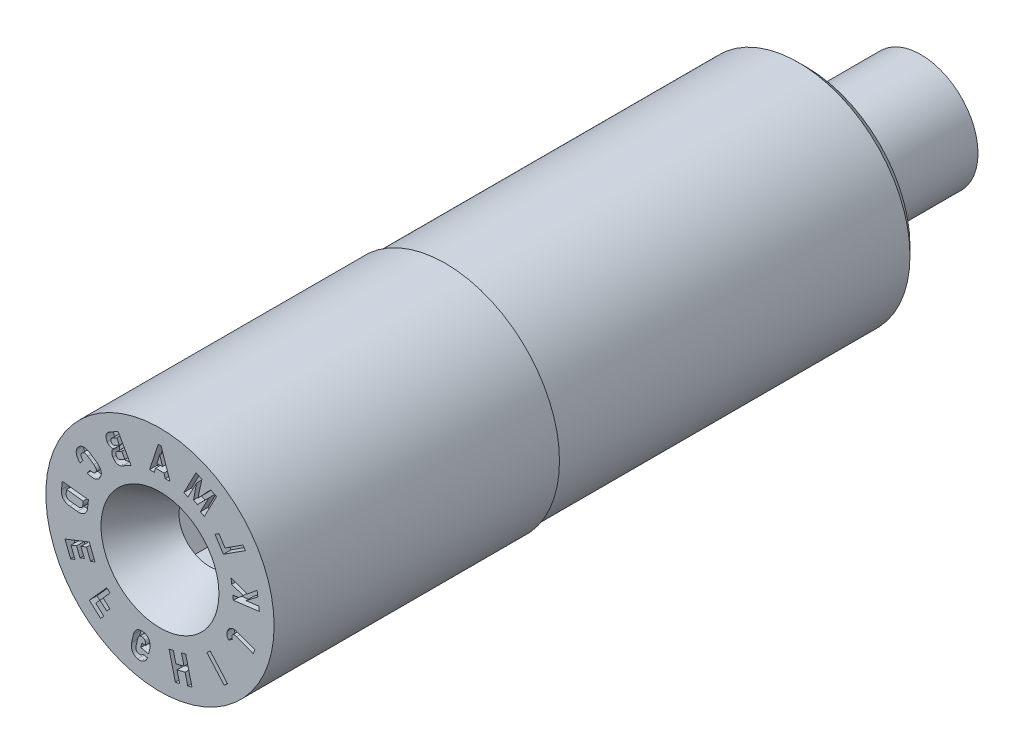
SolidWorks part; units mm, degrees
other "<M3L6-SetScrew>-<Chamfer1>"
ref_plane "Front Plane" through (0, 0, 0) normal (0, 0, 1) x (1, 0, 0)
ref_plane "Top Plane" through (0, 0, 0) normal (0, 1, 0) x (1, 0, 0)
ref_plane "Right Plane" through (0, 0, 0) normal (1, 0, 0) x (0, 0, -1)
sketch "Sketch1" plane through (0, 0, 0) normal (1, 0, 0) x (0, 0, -1)
  line L0 (0, 1.55) -> (1.299, 0.8)
  line L2 (0, 3) -> (0, 1.55)
  line L3 (16.7125, 3) -> (0, 3)
  line L4 (-3.7979, 0) -> (49996.2021, 0) construction
  line L8 (14, 0.8) -> (1.299, 0.8)
  line L12 (17, 1.5) -> (17, 2.7125)
  line L16 (17, 2.7125) -> (16.7125, 3)
  line L17 (17, 1.5) -> (14, 1.5)
  line L18 (14, 0.8) -> (14, 1.5)
  dimension "D1" = 17
  dimension "D2" = 45
  dimension "D3" = 0.2875
  dimension "D4" = 6
  dimension "D5" = 30
  dimension "D6" = 1.55
  dimension "D7" = 1.6
  dimension "D8" = 3
  dimension "D9" = 3
revolve "Revolve1" add sketch "Sketch1" angle 360 about L4
sketch "Sketch5" plane through (0, 0, 0) normal (1, 0, 0) x (0, 0, -1)
  line L0 (0, 0) -> (50000, 0) construction
  line L1 (0, 3) -> (0, -3) construction
  line L2 (7.5, 2.935) -> (17, 2.935)
  line L3 (7.5, 2.935) -> (7.5, 3.935)
  line L4 (7.5, 3.935) -> (17, 3.935)
  line L5 (17, 2.935) -> (17, 3.935)
  line L6 (17, -2.7125) -> (17, 2.7125) construction
  line L7 (16.7125, 3) -> (0, 3) construction
  dimension "D1" = 7.5
  dimension "D2" = 0.065
  dimension "D3" = 1
revolve "Cut-Revolve1" cut sketch "Sketch5" angle 360 about L0
sketch "Sketch2" plane through (0, 0, 0) normal (0, 0, 1) x (1, 0, 0)
  line L0 (0, 0) -> (0, 3) construction
  line L1 (0, 0) -> (1.3942, 2.6564) construction
  line L2 (0, 0) -> (2.469, 1.7042) construction
  line L3 (0, 0) -> (2.9781, 0.3616) construction
  line L4 (0, 0) -> (2.805, -1.0638) construction
  line L5 (0, 0) -> (1.9894, -2.2455) construction
  line L6 (0, 0) -> (0.7179, -2.9128) construction
  line L7 (0, 0) -> (-0.7179, -2.9128) construction
  line L8 (0, 0) -> (-1.9894, -2.2455) construction
  line L9 (0, 0) -> (-2.805, -1.0638) construction
  line L10 (0, 0) -> (-2.9781, 0.3616) construction
  line L11 (0, 0) -> (-2.469, 1.7042) construction
  line L12 (2.2591, 0.2002) -> (2.5723, 0.4407)
  line L13 (2.5723, 0.4407) -> (2.5537, 0.584)
  line L14 (2.5537, 0.584) -> (2.2946, 0.3683)
  line L15 (-1.0044, 1.9697) -> (-0.9226, 1.8252)
  line L16 (2.6124, 0.1302) -> (2.5976, 0.244)
  line L17 (2.5976, 0.244) -> (2.2591, 0.2002)
  line L18 (1.914, 0.1556) -> (1.9288, 0.0418)
  line L19 (1.9288, 0.0418) -> (2.6124, 0.1302)
  line L20 (2.1872, 0.2789) -> (2.0621, 0.1747)
  line L21 (2.2946, 0.3683) -> (1.8669, 0.5209)
  line L22 (1.8669, 0.5209) -> (1.8843, 0.3859)
  line L23 (1.8843, 0.3859) -> (2.1872, 0.2789)
  line L24 (2.2451, 1.3331) -> (2.183, 1.4295)
  line L25 (2.183, 1.4295) -> (1.7097, 1.1243)
  line L26 (0, 0) -> (-1.3942, 2.6564) construction
  line L27 (1.6668, 0.9602) -> (2.2451, 1.3331)
  line L28 (1.7101, 1.1237) -> (1.551, 1.3706)
  line L29 (1.551, 1.3706) -> (1.446, 1.3028)
  line L30 (1.446, 1.3028) -> (1.6668, 0.9602)
  line L31 (2.0621, 0.1747) -> (1.914, 0.1556)
  line L32 (0.0278, 2.6075) -> (-0.0449, 2.6072)
  line L33 (-0.0449, 2.6072) -> (-0.2741, 1.9163)
  line L34 (-0.2741, 1.9163) -> (-0.1509, 1.9168)
  line L35 (-0.1509, 1.9168) -> (-0.1173, 2.0274)
  line L36 (-0.0075, 2.3885) -> (0.066, 2.1534)
  line L37 (0.1396, 1.9179) -> (0.2628, 1.9184)
  line L38 (0.2628, 1.9184) -> (0.0278, 2.6075)
  line L39 (0.066, 2.1534) -> (-0.0792, 2.1528)
  line L40 (-0.0792, 2.1528) -> (-0.0075, 2.3885)
  line L41 (-0.1173, 2.0274) -> (0.1051, 2.0283)
  line L42 (0.1051, 2.0283) -> (0.1396, 1.9179)
  line L43 (-0.9226, 1.8252) -> (-1.0356, 1.7612)
  line L44 (-1.1479, 1.7919) -> (-1.1486, 1.7932)
  line L45 (-1.1175, 1.9057) -> (-1.0044, 1.9697)
  line L46 (-2.0757, -0.7319) -> (-1.932, -0.6756)
  line L47 (-1.0661, 2.0787) -> (-1.1791, 2.0147)
  line L48 (-1.252, 2.1436) -> (-1.139, 2.2076)
  line L49 (-1.4941, -1.6139) -> (-1.3114, -1.41)
  line L50 (-1.1008, 2.3731) -> (-1.317, 2.2507)
  line L51 (-1.2396, 1.7192) -> (-1.2389, 1.718)
  line L52 (-0.9833, 1.6468) -> (-0.7609, 1.7727)
  line L53 (0.6615, -2.228) -> (0.7298, -2.5057)
  line L54 (0.4184, -2.1583) -> (0.3515, -1.8861)
  line L55 (-1.139, 2.2076) -> (-1.0661, 2.0787)
  line L56 (1.1002, 2.382) -> (0.9482, 2.4613)
  line L57 (-0.7609, 1.7727) -> (-1.1008, 2.3731)
  line L58 (-1.6724, 1.3979) -> (-1.8288, 1.5049)
  line L59 (-2.0935, 1.1528) -> (-2.0261, 1.2512)
  line L60 (-1.8962, 1.4063) -> (-1.7399, 1.2993)
  line L61 (-1.838, 1.1225) -> (-1.9054, 1.0241)
  line L62 (-2.0183, 0.3268) -> (-2.028, 0.2384)
  line L63 (-2.1586, 0.1339) -> (-2.3606, 0.1563)
  line L64 (-2.4649, 0.2869) -> (-2.4552, 0.3753)
  line L65 (0.9482, 2.4613) -> (0.6291, 1.8494)
  line L66 (-2.5671, 0.5028) -> (-2.5893, 0.3031)
  line L67 (-2.3699, 0.0381) -> (-2.1754, 0.0165)
  line L68 (-1.9032, 0.2275) -> (-1.881, 0.4267)
  line L69 (0.6291, 1.8494) -> (0.734, 1.7948)
  line L70 (0.734, 1.7948) -> (0.9604, 2.2291)
  line L71 (-2.4552, 0.3753) -> (-2.0183, 0.3268)
  line L72 (0.9604, 2.2291) -> (0.8823, 1.8042)
  line L73 (-1.881, 0.4267) -> (-2.5671, 0.5028)
  line L74 (0.8823, 1.8042) -> (0.9842, 1.7511)
  line L75 (-2.3401, -0.8355) -> (-2.192, -0.7775)
  line L76 (0.9842, 1.7511) -> (1.2838, 2.0506)
  line L77 (-1.8574, -0.5236) -> (-2.4982, -0.7747)
  line L78 (-1.932, -0.6756) -> (-1.8254, -0.9477)
  line L79 (-1.8254, -0.9477) -> (-1.7092, -0.9021)
  line L80 (-1.7092, -0.9021) -> (-1.8574, -0.5236)
  line L81 (1.2838, 2.0506) -> (1.0614, 1.6241)
  line L82 (-2.192, -0.7775) -> (-2.1022, -1.0068)
  line L83 (-2.1022, -1.0068) -> (-1.9859, -0.9612)
  line L84 (-1.9859, -0.9612) -> (-2.0757, -0.7319)
  line L85 (1.0614, 1.6241) -> (1.1662, 1.5695)
  line L86 (-2.4982, -0.7747) -> (-2.3499, -1.1533)
  line L87 (-2.3499, -1.1533) -> (-2.2335, -1.1076)
  line L88 (-2.2335, -1.1076) -> (-2.3401, -0.8355)
  line L89 (1.1662, 1.5695) -> (1.4853, 2.1813)
  line L90 (1.4853, 2.1813) -> (1.3333, 2.2604)
  line L91 (-1.6883, -1.8306) -> (-1.5778, -1.7073)
  line L92 (-1.3114, -1.41) -> (-1.3968, -1.3335)
  line L93 (-1.3968, -1.3335) -> (-1.8572, -1.8475)
  line L94 (-1.5778, -1.7073) -> (-1.4001, -1.8664)
  line L95 (-1.4001, -1.8664) -> (-1.3165, -1.7731)
  line L96 (-1.3165, -1.7731) -> (-1.4941, -1.6139)
  line L97 (1.3333, 2.2604) -> (1.0017, 1.9089)
  line L98 (-1.8572, -1.8475) -> (-1.56, -2.1137)
  line L99 (-1.56, -2.1137) -> (-1.4764, -2.0204)
  line L100 (-1.4764, -2.0204) -> (-1.6883, -1.8306)
  line L101 (1.0017, 1.9089) -> (1.1002, 2.382)
  line L102 (-0.2986, -2.2942) -> (-0.2686, -2.1627)
  line L103 (-0.6983, -2.0491) -> (-0.7436, -2.2477)
  line L104 (-0.3272, -2.3967) -> (-0.4477, -2.3692)
  line L105 (-0.628, -2.274) -> (-0.5827, -2.0755)
  line L106 (-0.3837, -2.1345) -> (-0.3863, -2.1456)
  line L107 (-0.3863, -2.1456) -> (-0.4759, -2.1252)
  line L108 (-0.4759, -2.1252) -> (-0.5039, -2.2473)
  line L109 (-0.5039, -2.2473) -> (-0.2986, -2.2942)
  line L110 (0.7298, -2.5057) -> (0.8415, -2.4783)
  line L111 (0.8415, -2.4783) -> (0.6763, -1.8062)
  line L112 (0.6763, -1.8062) -> (0.5645, -1.8337)
  line L113 (0.5645, -1.8337) -> (0.6315, -2.1059)
  line L114 (0.4049, -2.5857) -> (0.5167, -2.5582)
  line L115 (0.5167, -2.5582) -> (0.4484, -2.2804)
  line L116 (0.3515, -1.8861) -> (0.2396, -1.9136)
  line L117 (0.2396, -1.9136) -> (0.4049, -2.5857)
  line L118 (0.4484, -2.2804) -> (0.6615, -2.228)
  line L120 (0.6315, -2.1059) -> (0.4184, -2.1583)
  line L122 (1.8012, -0.9222) -> (1.9069, -0.8626)
  line L123 (2.012, -0.7432) -> (2.4495, -0.9121)
  line L124 (2.4495, -0.9121) -> (2.4924, -0.8012)
  line L125 (2.4924, -0.8012) -> (2.0545, -0.632)
  line L126 (1.3203, -1.4144) -> (1.2312, -1.4926)
  line L127 (1.2312, -1.4926) -> (1.6866, -2.0112)
  line L128 (1.6866, -2.0112) -> (1.7757, -1.933)
  line L129 (1.7757, -1.933) -> (1.3203, -1.4144)
  circle A0 centre (0, 0) radius 3 construction
  circle A1 centre (0, 0) radius 1.9375 construction
  spline S0 degree 3 poles (-1.0356, 1.7612) (-1.0459, 1.7554) (-1.0619, 1.7485) (-1.0842, 1.7471) (-1.0995, 1.7493) (-1.1138, 1.7552) (-1.132, 1.7678) (-1.1421, 1.7818) (-1.1479, 1.7919) knots 0 0 0 0 0.26905 0.386758 0.5017 0.616922 0.734143 1 1 1 1
  spline S1 degree 3 poles (-1.1486, 1.7932) (-1.1523, 1.8003) (-1.1578, 1.8109) (-1.1611, 1.8259) (-1.1623, 1.8365) (-1.1618, 1.8468) (-1.1601, 1.8568) (-1.1564, 1.8663) (-1.1515, 1.8754) (-1.1452, 1.884) (-1.1342, 1.8948) (-1.1245, 1.9017) (-1.1175, 1.9057) knots 0 0 0 0 0.182941 0.266967 0.346528 0.423909 0.49977 0.575297 0.652801 0.732708 0.816841 1 1 1 1
  spline S2 degree 3 poles (-1.1791, 2.0147) (-1.1883, 2.0093) (-1.2029, 2.0037) (-1.2231, 2.0022) (-1.2371, 2.0048) (-1.2503, 2.0106) (-1.2671, 2.0229) (-1.2768, 2.0361) (-1.2821, 2.0458) knots 0 0 0 0 0.261977 0.377727 0.49196 0.607887 0.727892 1 1 1 1
  spline S3 degree 3 poles (-1.2821, 2.0458) (-1.2871, 2.0544) (-1.2927, 2.0682) (-1.2937, 2.0873) (-1.2911, 2.1006) (-1.2857, 2.1132) (-1.2738, 2.1292) (-1.2612, 2.1384) (-1.252, 2.1436) knots 0 0 0 0 0.258446 0.374554 0.489401 0.605415 0.725691 1 1 1 1
  spline S4 degree 3 poles (-1.317, 2.2507) (-1.333, 2.2416) (-1.3552, 2.2264) (-1.3798, 2.2017) (-1.3943, 2.1823) (-1.4055, 2.1618) (-1.4134, 2.1403) (-1.4176, 2.1177) (-1.4184, 2.0943) (-1.4157, 2.0703) (-1.4073, 2.0365) (-1.3961, 2.0121) (-1.387, 1.9962) knots 0 0 0 0 0.184023 0.26743 0.347474 0.424849 0.500285 0.576178 0.653357 0.733286 0.817102 1 1 1 1
  spline S5 degree 3 poles (-1.387, 1.9962) (-1.381, 1.9849) (-1.3701, 1.9696) (-1.3534, 1.9517) (-1.34, 1.9408) (-1.3259, 1.9315) (-1.311, 1.9244) (-1.2954, 1.9193) (-1.2791, 1.9163) (-1.2623, 1.9153) (-1.2387, 1.9167) (-1.2211, 1.9209) (-1.2094, 1.9248) knots 0 0 0 0 0.182465 0.267267 0.349177 0.428902 0.506921 0.58456 0.663164 0.743124 0.825026 1 1 1 1
  spline S6 degree 3 poles (-1.2094, 1.9248) (-1.2197, 1.9169) (-1.2334, 1.9035) (-1.2478, 1.883) (-1.2562, 1.867) (-1.2621, 1.8501) (-1.266, 1.8327) (-1.2675, 1.8146) (-1.2664, 1.7961) (-1.2634, 1.7771) (-1.2555, 1.7508) (-1.2469, 1.7316) (-1.2396, 1.7192) knots 0 0 0 0 0.169562 0.248935 0.327655 0.405299 0.482357 0.56114 0.641663 0.725284 0.812159 1 1 1 1
  spline S7 degree 3 poles (-1.2389, 1.718) (-1.2298, 1.7019) (-1.2146, 1.6794) (-1.1896, 1.6548) (-1.1702, 1.6401) (-1.1496, 1.6286) (-1.1279, 1.6208) (-1.1053, 1.6163) (-1.0818, 1.6155) (-1.0577, 1.618) (-1.0238, 1.6266) (-0.9992, 1.6375) (-0.9833, 1.6468) knots 0 0 0 0 0.18374 0.267641 0.347802 0.425241 0.500762 0.57656 0.653764 0.733671 0.817074 1 1 1 1
  spline S8 degree 3 poles (-1.5851, 1.0701) (-1.5789, 1.0794) (-1.5701, 1.0935) (-1.5606, 1.1131) (-1.5545, 1.1275) (-1.55, 1.1421) (-1.5461, 1.1565) (-1.5438, 1.1711) (-1.5422, 1.1856) (-1.5422, 1.2001) (-1.5429, 1.2145) (-1.545, 1.2287) (-1.5483, 1.2427) (-1.5524, 1.2567) (-1.5578, 1.2707) (-1.5645, 1.2844) (-1.5721, 1.298) (-1.581, 1.3113) (-1.5907, 1.3245) (-1.6017, 1.3374) (-1.6138, 1.35) (-1.6269, 1.3624) (-1.646, 1.379) (-1.6616, 1.3905) (-1.6724, 1.3979) knots 0 0 0 0 0.087233 0.129069 0.169541 0.209036 0.247781 0.286035 0.323896 0.361474 0.39854 0.435835 0.472937 0.510947 0.549563 0.589025 0.629545 0.67095 0.713741 0.757409 0.802834 0.849349 0.89775 1 1 1 1
  spline S9 degree 3 poles (-1.8288, 1.5049) (-1.8396, 1.5124) (-1.8561, 1.5225) (-1.8783, 1.5347) (-1.8948, 1.5422) (-1.9108, 1.5491) (-1.9269, 1.5544) (-1.9427, 1.5589) (-1.9584, 1.5623) (-1.9738, 1.5645) (-1.989, 1.5657) (-2.0039, 1.5656) (-2.0185, 1.5647) (-2.0328, 1.5624) (-2.0468, 1.5591) (-2.0606, 1.555) (-2.074, 1.5495) (-2.087, 1.5429) (-2.0998, 1.5355) (-2.112, 1.5268) (-2.1239, 1.5172) (-2.1352, 1.5064) (-2.1499, 1.4904) (-2.1602, 1.4774) (-2.1665, 1.468) knots 0 0 0 0 0.102142 0.150603 0.197513 0.242633 0.28651 0.329076 0.370739 0.411156 0.45052 0.489036 0.527074 0.564224 0.601656 0.638856 0.676278 0.714231 0.752196 0.791151 0.8305 0.870939 0.912582 1 1 1 1
  spline S10 degree 3 poles (-2.1665, 1.468) (-2.1768, 1.4529) (-2.1895, 1.4285) (-2.1991, 1.3937) (-2.2021, 1.3672) (-2.2017, 1.3403) (-2.1971, 1.3132) (-2.1889, 1.2859) (-2.177, 1.2586) (-2.1615, 1.2314) (-2.135, 1.1946) (-2.1111, 1.169) (-2.0935, 1.1528) knots 0 0 0 0 0.154567 0.229209 0.303547 0.378669 0.45516 0.534686 0.617985 0.705746 0.798149 1 1 1 1
  spline S11 degree 3 poles (-2.0261, 1.2512) (-2.0339, 1.2589) (-2.0442, 1.2712) (-2.0558, 1.2884) (-2.0626, 1.301) (-2.0678, 1.3136) (-2.0715, 1.326) (-2.0736, 1.3383) (-2.074, 1.3503) (-2.073, 1.3621) (-2.0691, 1.3773) (-2.0636, 1.388) (-2.0592, 1.3945) knots 0 0 0 0 0.204978 0.299357 0.388937 0.473703 0.553626 0.630555 0.705965 0.778794 0.851518 1 1 1 1
  spline S12 degree 3 poles (-2.0592, 1.3945) (-2.0535, 1.4028) (-2.0438, 1.4143) (-2.028, 1.4256) (-2.0157, 1.432) (-2.0027, 1.436) (-1.989, 1.4381) (-1.9746, 1.4378) (-1.9596, 1.4358) (-1.9442, 1.4313) (-1.9223, 1.4228) (-1.9066, 1.4132) (-1.8962, 1.4063) knots 0 0 0 0 0.163821 0.239689 0.313407 0.386873 0.460423 0.537618 0.61862 0.705136 0.796781 1 1 1 1
  spline S13 degree 3 poles (-1.7399, 1.2993) (-1.7297, 1.2921) (-1.7152, 1.281) (-1.6993, 1.2638) (-1.6898, 1.251) (-1.6823, 1.2379) (-1.6772, 1.2245) (-1.674, 1.2111) (-1.6733, 1.1974) (-1.6744, 1.1837) (-1.6799, 1.1651) (-1.6864, 1.1517) (-1.6924, 1.1436) knots 0 0 0 0 0.203418 0.294737 0.380965 0.461768 0.538625 0.612958 0.685938 0.760134 0.83614 1 1 1 1
  spline S14 degree 3 poles (-1.6924, 1.1436) (-1.6971, 1.137) (-1.7049, 1.1277) (-1.7178, 1.1184) (-1.7283, 1.1129) (-1.7396, 1.109) (-1.7518, 1.1063) (-1.7647, 1.1054) (-1.7783, 1.1058) (-1.7925, 1.1077) (-1.8129, 1.1122) (-1.8278, 1.1182) (-1.838, 1.1225) knots 0 0 0 0 0.150261 0.223488 0.296087 0.370429 0.446836 0.527115 0.610974 0.700548 0.794181 1 1 1 1
  spline S15 degree 3 poles (-1.9054, 1.0241) (-1.8837, 1.014) (-1.8513, 1.0004) (-1.8072, 0.9896) (-1.7763, 0.9848) (-1.7466, 0.9837) (-1.7182, 0.9857) (-1.6914, 0.9915) (-1.666, 1.0005) (-1.6426, 1.0131) (-1.6134, 1.0341) (-1.5956, 1.055) (-1.5851, 1.0701) knots 0 0 0 0 0.202203 0.294606 0.382493 0.465999 0.545154 0.621761 0.69694 0.771301 0.845139 1 1 1 1
  spline S16 degree 3 poles (-2.028, 0.2384) (-2.029, 0.2295) (-2.0312, 0.2166) (-2.0365, 0.2005) (-2.0409, 0.1895) (-2.0467, 0.1796) (-2.0529, 0.1703) (-2.0603, 0.1622) (-2.0684, 0.1549) (-2.0772, 0.1486) (-2.0868, 0.1433) (-2.0971, 0.139) (-2.1081, 0.1359) (-2.1198, 0.1337) (-2.1367, 0.1325) (-2.1497, 0.1329) (-2.1586, 0.1339) knots 0 0 0 0 0.140586 0.205164 0.267373 0.327599 0.385572 0.443109 0.50013 0.557324 0.614345 0.672558 0.732716 0.794789 0.859227 1 1 1 1
  spline S17 degree 3 poles (-2.3606, 0.1563) (-2.3695, 0.1572) (-2.3823, 0.1597) (-2.3986, 0.1645) (-2.4095, 0.1693) (-2.4196, 0.1748) (-2.4288, 0.1811) (-2.4369, 0.1884) (-2.4442, 0.1966) (-2.4506, 0.2054) (-2.4557, 0.2151) (-2.46, 0.2254) (-2.4632, 0.2364) (-2.4651, 0.2481) (-2.4667, 0.265) (-2.4657, 0.278) (-2.4649, 0.2869) knots 0 0 0 0 0.140512 0.205608 0.268014 0.327901 0.385841 0.443345 0.500333 0.557494 0.614693 0.672873 0.732996 0.794844 0.859368 1 1 1 1
  spline S18 degree 3 poles (-2.5893, 0.3031) (-2.5906, 0.291) (-2.5916, 0.273) (-2.5915, 0.2494) (-2.5899, 0.2325) (-2.5879, 0.2162) (-2.5844, 0.2006) (-2.5802, 0.1856) (-2.5751, 0.1711) (-2.5689, 0.1573) (-2.5617, 0.1443) (-2.5537, 0.1319) (-2.5448, 0.1201) (-2.535, 0.1091) (-2.5242, 0.0989) (-2.5125, 0.0893) (-2.5, 0.0804) (-2.4865, 0.0725) (-2.4723, 0.065) (-2.4571, 0.0586) (-2.4412, 0.0529) (-2.4245, 0.048) (-2.4008, 0.0424) (-2.3824, 0.0395) (-2.3699, 0.0381) knots 0 0 0 0 0.093432 0.137818 0.181158 0.222724 0.263627 0.30352 0.342577 0.38116 0.419013 0.456656 0.494298 0.531898 0.569704 0.608161 0.647276 0.687272 0.728161 0.770184 0.813308 0.857685 0.90345 1 1 1 1
  spline S19 degree 3 poles (-2.1754, 0.0165) (-2.1635, 0.015) (-2.1457, 0.0141) (-2.1223, 0.0141) (-2.1055, 0.0153) (-2.0892, 0.0174) (-2.0734, 0.0203) (-2.0581, 0.0241) (-2.0433, 0.0288) (-2.0291, 0.0344) (-2.0155, 0.0409) (-2.0027, 0.0485) (-1.9903, 0.0567) (-1.9788, 0.0661) (-1.968, 0.0765) (-1.9578, 0.0876) (-1.9483, 0.0997) (-1.9396, 0.1127) (-1.9317, 0.1265) (-1.9247, 0.1412) (-1.9185, 0.1568) (-1.9135, 0.1733) (-1.9074, 0.1967) (-1.9046, 0.215) (-1.9032, 0.2275) knots 0 0 0 0 0.092119 0.136531 0.179458 0.221355 0.26236 0.30262 0.342291 0.381213 0.419577 0.45779 0.495646 0.533544 0.571504 0.610206 0.649406 0.689332 0.730199 0.771744 0.814183 0.858418 0.904002 1 1 1 1
  spline S20 degree 3 poles (-0.2686, -2.1627) (-0.2659, -2.1506) (-0.2625, -2.1325) (-0.26, -2.1084) (-0.259, -2.0909) (-0.2591, -2.0738) (-0.26, -2.0571) (-0.2621, -2.0407) (-0.265, -2.0247) (-0.2687, -2.0092) (-0.2736, -1.9944) (-0.2791, -1.9801) (-0.2856, -1.9665) (-0.2931, -1.9536) (-0.3012, -1.9413) (-0.3105, -1.9298) (-0.3204, -1.9188) (-0.3311, -1.9086) (-0.3428, -1.8994) (-0.3549, -1.8908) (-0.3678, -1.8833) (-0.3815, -1.8766) (-0.4009, -1.8687) (-0.4161, -1.8642) (-0.4265, -1.8618) knots 0 0 0 0 0.097617 0.144298 0.190203 0.234736 0.278397 0.321803 0.364168 0.406122 0.446692 0.48669 0.526219 0.564751 0.603265 0.64199 0.680567 0.719496 0.757996 0.796937 0.835914 0.875622 0.916265 1 1 1 1
  spline S21 degree 3 poles (-0.4265, -1.8618) (-0.437, -1.8593) (-0.4527, -1.8569) (-0.4737, -1.8551) (-0.489, -1.8552) (-0.504, -1.8561) (-0.5188, -1.8578) (-0.5332, -1.861) (-0.5474, -1.865) (-0.5612, -1.8699) (-0.5745, -1.876) (-0.5872, -1.8828) (-0.5995, -1.8905) (-0.6112, -1.8992) (-0.6224, -1.9089) (-0.6329, -1.9195) (-0.6431, -1.9309) (-0.6524, -1.9432) (-0.6614, -1.956) (-0.6693, -1.9698) (-0.6766, -1.9843) (-0.6832, -1.9994) (-0.6909, -2.021) (-0.6959, -2.0376) (-0.6983, -2.0491) knots 0 0 0 0 0.086815 0.128493 0.169609 0.210194 0.250046 0.289654 0.329266 0.368727 0.407618 0.446765 0.485286 0.524719 0.564216 0.604518 0.64549 0.687131 0.729071 0.771906 0.815214 0.85988 0.905255 1 1 1 1
  spline S22 degree 3 poles (-0.7436, -2.2477) (-0.7463, -2.2598) (-0.7496, -2.2779) (-0.7522, -2.3021) (-0.7531, -2.3195) (-0.753, -2.3366) (-0.7521, -2.3533) (-0.75, -2.3696) (-0.7472, -2.3855) (-0.7433, -2.4009) (-0.7386, -2.4157) (-0.733, -2.4299) (-0.7265, -2.4434) (-0.7192, -2.4563) (-0.711, -2.4686) (-0.7017, -2.4801) (-0.6918, -2.4911) (-0.6809, -2.5011) (-0.6696, -2.5106) (-0.6574, -2.519) (-0.6445, -2.5265) (-0.6308, -2.5332) (-0.6114, -2.5411) (-0.5962, -2.5455) (-0.5858, -2.5479) knots 0 0 0 0 0.097786 0.144914 0.190535 0.235145 0.278881 0.322016 0.364454 0.406151 0.446791 0.486554 0.525633 0.564503 0.603084 0.641875 0.680519 0.719328 0.758058 0.796586 0.835631 0.875408 0.916121 1 1 1 1
  spline S23 degree 3 poles (-0.5858, -2.5479) (-0.5687, -2.5518) (-0.5424, -2.5548) (-0.5076, -2.5518) (-0.4823, -2.546) (-0.4576, -2.5374) (-0.4342, -2.5253) (-0.4119, -2.5106) (-0.3912, -2.4927) (-0.372, -2.4723) (-0.3487, -2.4412) (-0.335, -2.415) (-0.3272, -2.3967) knots 0 0 0 0 0.161055 0.240119 0.319613 0.39948 0.479531 0.560487 0.644137 0.729965 0.817215 1 1 1 1
  spline S24 degree 3 poles (-0.4477, -2.3692) (-0.4512, -2.3756) (-0.4575, -2.3845) (-0.4676, -2.3949) (-0.476, -2.4015) (-0.4851, -2.4071) (-0.4945, -2.4116) (-0.5043, -2.4152) (-0.5246, -2.42) (-0.5423, -2.4194) (-0.5557, -2.4165) knots 0 0 0 0 0.17307 0.257817 0.342272 0.426288 0.508487 0.590416 0.673346 1 1 1 1
  spline S25 degree 3 poles (-0.5557, -2.4165) (-0.5651, -2.4143) (-0.5787, -2.4096) (-0.5945, -2.3992) (-0.6049, -2.3901) (-0.6138, -2.3794) (-0.6208, -2.3673) (-0.6265, -2.354) (-0.6304, -2.3396) (-0.6325, -2.3242) (-0.633, -2.3021) (-0.6306, -2.2852) (-0.628, -2.274) knots 0 0 0 0 0.160706 0.237501 0.314236 0.391285 0.468827 0.547922 0.631285 0.717518 0.80715 1 1 1 1
  spline S26 degree 3 poles (-0.5827, -2.0755) (-0.5804, -2.0656) (-0.5758, -2.0512) (-0.5662, -2.034) (-0.5577, -2.0228) (-0.5482, -2.013) (-0.5376, -2.0047) (-0.5258, -1.9984) (-0.5131, -1.9937) (-0.4997, -1.9909) (-0.4807, -1.9891) (-0.4662, -1.9913) (-0.4566, -1.9933) knots 0 0 0 0 0.180297 0.26421 0.346936 0.427679 0.505999 0.584125 0.663209 0.743675 0.825457 1 1 1 1
  spline S27 degree 3 poles (-0.4566, -1.9933) (-0.4471, -1.9956) (-0.4333, -2.0002) (-0.4173, -2.0104) (-0.4068, -2.0192) (-0.3979, -2.0296) (-0.3907, -2.0413) (-0.3851, -2.0543) (-0.3813, -2.0685) (-0.3791, -2.0838) (-0.3786, -2.1061) (-0.3813, -2.123) (-0.3837, -2.1345) knots 0 0 0 0 0.163193 0.240603 0.316743 0.391895 0.467889 0.546499 0.628266 0.713929 0.80373 1 1 1 1
  spline S28 degree 3 poles (1.7738, -0.7318) (1.7674, -0.7484) (1.7604, -0.7739) (1.7584, -0.8086) (1.7602, -0.8336) (1.7654, -0.8578) (1.7768, -0.8888) (1.7906, -0.9096) (1.8012, -0.9222) knots 0 0 0 0 0.264095 0.388879 0.512536 0.634397 0.755301 1 1 1 1
  spline S29 degree 3 poles (1.9069, -0.8626) (1.9021, -0.8557) (1.8962, -0.8445) (1.891, -0.8287) (1.8884, -0.8169) (1.8875, -0.805) (1.888, -0.7896) (1.8908, -0.7784) (1.8935, -0.7713) knots 0 0 0 0 0.265014 0.391861 0.519139 0.642856 0.763156 1 1 1 1
  spline S30 degree 3 poles (1.8935, -0.7713) (1.8971, -0.7619) (1.9053, -0.7488) (1.9221, -0.7375) (1.9368, -0.7324) (1.9534, -0.7306) (1.9792, -0.7321) (1.9988, -0.7382) (2.012, -0.7432) knots 0 0 0 0 0.220694 0.325991 0.436994 0.556707 0.688683 1 1 1 1
  spline S31 degree 3 poles (2.0545, -0.632) (2.0337, -0.6243) (2.0028, -0.6144) (1.9613, -0.6092) (1.9328, -0.6086) (1.9058, -0.6119) (1.8806, -0.6186) (1.8573, -0.629) (1.8359, -0.6429) (1.8167, -0.6603) (1.7935, -0.6887) (1.7806, -0.7138) (1.7738, -0.7318) knots 0 0 0 0 0.197119 0.286068 0.37004 0.450102 0.526194 0.600935 0.675643 0.75178 0.829873 1 1 1 1
  point P17 (0, 0)
  dimension "D1" = 13
  dimension "D2" = 3.875
extrude "Cut-Extrude1" cut sketch "Sketch2" against normal blind 0.2
ref_plane "Plane1" through (0, 0, -1.299) normal (0, 0, 1) x (1, 0, 0)
sketch "Sketch7" plane through (0, 0, -1.299) normal (0, 0, 1) x (1, 0, 0)
  line L1 (0.9238, 0) -> (0.4619, 0.8)
  line L2 (0.4619, 0.8) -> (-0.4619, 0.8)
  line L3 (-0.4619, 0.8) -> (-0.9238, 0)
  line L4 (-0.9238, 0) -> (-0.4619, -0.8)
  line L5 (-0.4619, -0.8) -> (0.4619, -0.8)
  line L6 (0.4619, -0.8) -> (0.9238, 0)
  circle A0 centre (0, 0) radius 0.8 construction
  circle A1 centre (0, 0) radius 0.8 construction
  point P1 (0, 0.8)
extrude "Cut-Extrude2" cut sketch "Sketch7" against normal blind 1.6
inserted part "M3L6-SetScrew"
move or copy body "Body-Move/Copy2" placed by mates yes
other "Distance1" parameters "D1"=3
